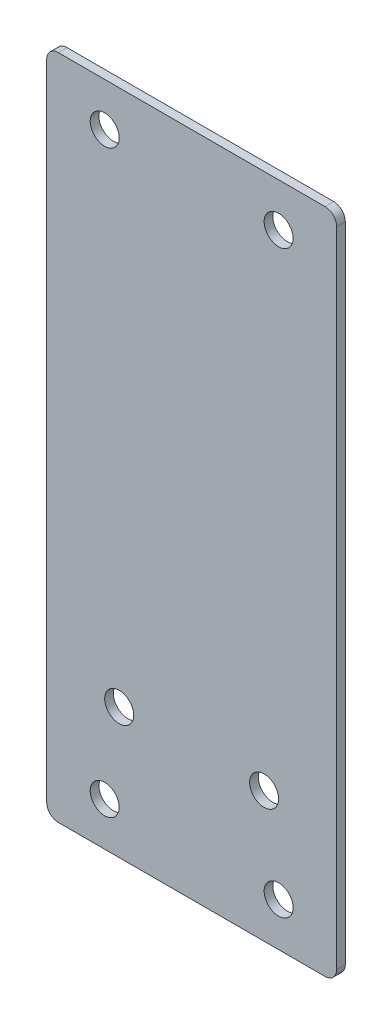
SolidWorks part; units mm, degrees
ref_plane "Plan de face" through (0, 0, 0) normal (0, 0, 1) x (1, 0, 0)
ref_plane "Plan de dessus" through (0, 0, 0) normal (0, 1, 0) x (1, 0, 0)
ref_plane "Plan de droite" through (0, 0, 0) normal (1, 0, 0) x (0, 0, -1)
sketch "Esquisse1" plane through (0, 0, 0) normal (0, 0, 1) x (1, 0, 0)
  line L1 (0, 0) -> (100, 0)
  line L2 (0, 0) -> (0, 230)
  line L3 (0, 230) -> (100, 230)
  line L4 (100, 0) -> (100, 230)
  dimension "D1" = 100
  dimension "D2" = 230
extrude "Boss.-Extru.1" add sketch "Esquisse1" along normal blind 3
sketch "Esquisse2" plane through (0, 0, 3) normal (0, 0, 1) x (1, 0, 0)
  line L0 (0, 230) -> (0, 0) construction
  line L1 (100, 230) -> (0, 230) construction
  line L2 (100, 0) -> (100, 230) construction
  line L3 (0, 0) -> (100, 0) construction
  circle A0 centre (20, 215) radius 5
  circle A1 centre (80, 215) radius 5
  circle A2 centre (20, 15) radius 5
  circle A3 centre (80, 15) radius 5
  dimension "D1" = 10
  dimension "D2" = 10
  dimension "D7" = 20
  dimension "D3" = 20
  dimension "D4" = 15
  dimension "D5" = 20
  dimension "D6" = 15
  dimension "D8" = 15
  dimension "D9" = 20
  dimension "D10" = 15
extrude "Enlèv. mat.-Extru.1" cut sketch "Esquisse2" against normal blind 3
fillet "Congé1" radius 4 4 edges at (0, 0, 1.5) (100, 0, 1.5) (100, 230, 1.5) (0, 230, 1.5)
sketch "Esquisse3" plane through (0, 0, 3) normal (0, 0, 1) x (1, 0, 0)
  line L0 (0, 226) -> (0, 4) construction
  line L1 (4, 0) -> (96, 0) construction
  circle A0 centre (25, 45) radius 5
  circle A1 centre (75, 45) radius 5
  dimension "D1" = 50
  dimension "D2" = 25
  dimension "D3" = 45
extrude "Enlèv. mat.-Extru.2" cut sketch "Esquisse3" against normal blind 10 contours A1
